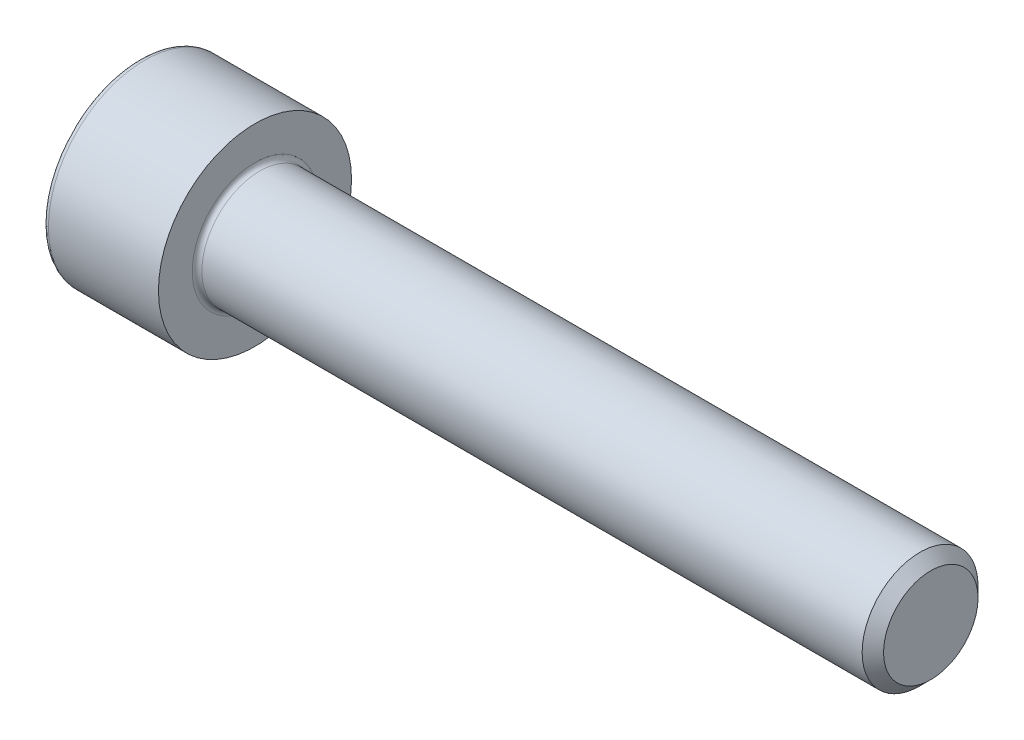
SolidWorks part; units mm, degrees
ref_plane "Plane1" through (0, 0, 0) normal (0, 0, 1) x (1, 0, 0)
ref_plane "Plane2" through (0, 0, 0) normal (0, 1, 0) x (1, 0, 0)
ref_plane "Plane3" through (0, 0, 0) normal (1, 0, 0) x (0, 0, -1)
sketch "BodySke" plane through (0, 0, 0) normal (0, 0, 1) x (1, 0, 0)
  line L0 (0, 0) -> (0, 5)
  line L1 (0, 5) -> (6, 5)
  line L2 (6, 5) -> (6, 3)
  line L3 (6, 3) -> (40.4455, 3)
  line L4 (41, 2.4455) -> (41, 0)
  line L5 (41, 0) -> (0, 0)
  line L6 (-31.75, 0) -> (127, 0) construction
  line L8 (41, 2.4455) -> (40.4455, 3)
  line L10 (41, -2.4455) -> (40.4455, -3) construction
  line L11 (7, 9.525) -> (7, 3.175) construction
  line L12 (6, 9.525) -> (6, 3.175) construction
  line L13 (-19, 9.525) -> (-19, 3.175) construction
  dimension "Diameter" = 6
  dimension "Head_ht" = 6
  dimension "Length" = 35
  dimension "Body_ch_ang" = 45
  dimension "Head_dia" = 10
  dimension "Minor_dia" = 4.891
  dimension "Advance" = 1
  dimension "Thread_nom" = 35
  dimension "Thread_length" = 60
revolve "Base-Revolve" add sketch "BodySke"
fillet "Fillet1" radius 0.25 1 edges at (6, 0, 3)
fillet "Fillet2" radius 0.3 1 edges at (0, 0, 5)
sketch "Sketch2" plane through (0, 0, 0) normal (0, 0, 1) x (1, 0, 0)
  line L0 (0, 2.542) -> (3, 2.542)
  line L1 (3, 2.542) -> (4.4676, 0)
  line L2 (-31.75, 0) -> (127, 0) construction
  line L3 (4.4676, 0) -> (0, 0)
  line L4 (0, 0) -> (0, 2.542)
  line L6 (0, 0) -> (47.625, 0) construction
  dimension "D1" = 2.542
  dimension "D2" = 60
  dimension "Depth" = 3
revolve "Hex-PreBroach" cut sketch "Sketch2" angle 360 about L6
sketch "Sketch3" plane through (0, 0, 0) normal (-1, 0, 0) x (0, 0.5, 0.866)
  line L0 (1.4676, 2.542) -> (-1.4676, 2.542)
  line L1 (-1.4676, 2.542) -> (-2.9352, 0)
  line L2 (1.4676, 2.542) -> (2.9352, 0)
  line L3 (1.4676, -2.542) -> (2.9352, 0)
  line L4 (1.4676, -2.542) -> (-1.4676, -2.542)
  line L5 (-1.4676, -2.542) -> (-2.9352, 0)
  dimension "D1" = 2.542
  dimension "D2" = 2.542
  dimension "Hex_size" = 5.084
extrude "Hex" cut sketch "Sketch3" against normal blind 3
sketch "ThdSchSke" plane through (0, 0, 0) normal (0, 0, 1) x (1, 0, 0)
  line L0 (9, -2.4455) -> (8.6117, -3)
  line L1 (9, -2.4455) -> (9.3883, -3)
  line L2 (9.3883, -3) -> (9.3883, -3.75)
  line L3 (-3.175, 0) -> (5.1513, 0) construction
  line L4 (0, 4.7) -> (0, -4.7) construction
  line L5 (9.3883, -3.75) -> (8.6117, -3.75)
  line L6 (8.6117, -3.75) -> (8.6117, -3)
  dimension "Thread_minor" = 4.891
  dimension "Diameter" = 6
  dimension "Start" = 9
  dimension "SideAngle" = 55
  dimension "VeeAngle" = 70
  dimension "Overcut" = 7.5
revolve "ThreadSchematic" [suppressed] cut sketch "ThdSchSke" angle 360 about L3
pattern_linear "ThdSchPat" [suppressed]
equation "\"D2@Sketch3\" = \"Hex_size@Sketch3\" / 2"
equation "\"D1@Sketch3\" = \"Hex_size@Sketch3\" / 2"
equation "\"D1@Sketch2\" = \"Hex_size@Sketch3\" / 2"
equation "\"Thread_minor@ThreadCosmetic\"  =  \"Minor_dia@BodySke\""
equation "\"Depth@Sketch2\" =  \"Key_eng@Hex\""
equation "\"Thread_length@ThreadCosmetic\" = ((sgn( (\"Length@BodySke\" - \"Advance@BodySke\" * 3.0) - \"Thread_nom@BodySke\" )-1)*( (\"Length@BodySke\" - \"Advance@BodySke\" * 3.0) - \"Thread_nom@BodySke\" ))/-2+ \"Thread_no"
equation "\"Thread_minor@ThdSchSke\" = \"Minor_dia@BodySke\""
equation "\"Diameter@ThdSchSke\" = \"Diameter@BodySke\""
equation "\"Overcut@ThdSchSke\" = \"Diameter@BodySke\" * 1.25"
equation "\"Start@ThdSchSke\" = \"Head_ht@BodySke\" + \"Length@BodySke\" - \"Thread_length@ThreadCosmetic\"  '---Non-countersunk---"
equation "\"Num_threads@ThdSchPat\" = int( \"Thread_length@ThreadCosmetic\" / \"Advance@BodySke\" + 0.999 )  + 1"
equation "\"Advance@ThdSchPat\" = \"Thread_length@ThreadCosmetic\" /  (\"Num_threads@ThdSchPat\" - 1) 'relax it"
equation "\"Num_threads@ThdSchPat\" = \"Num_threads@ThdSchPat\" - sgn( \"Num_threads@ThdSchPat\" - 1) '---chamfered tips only---"
